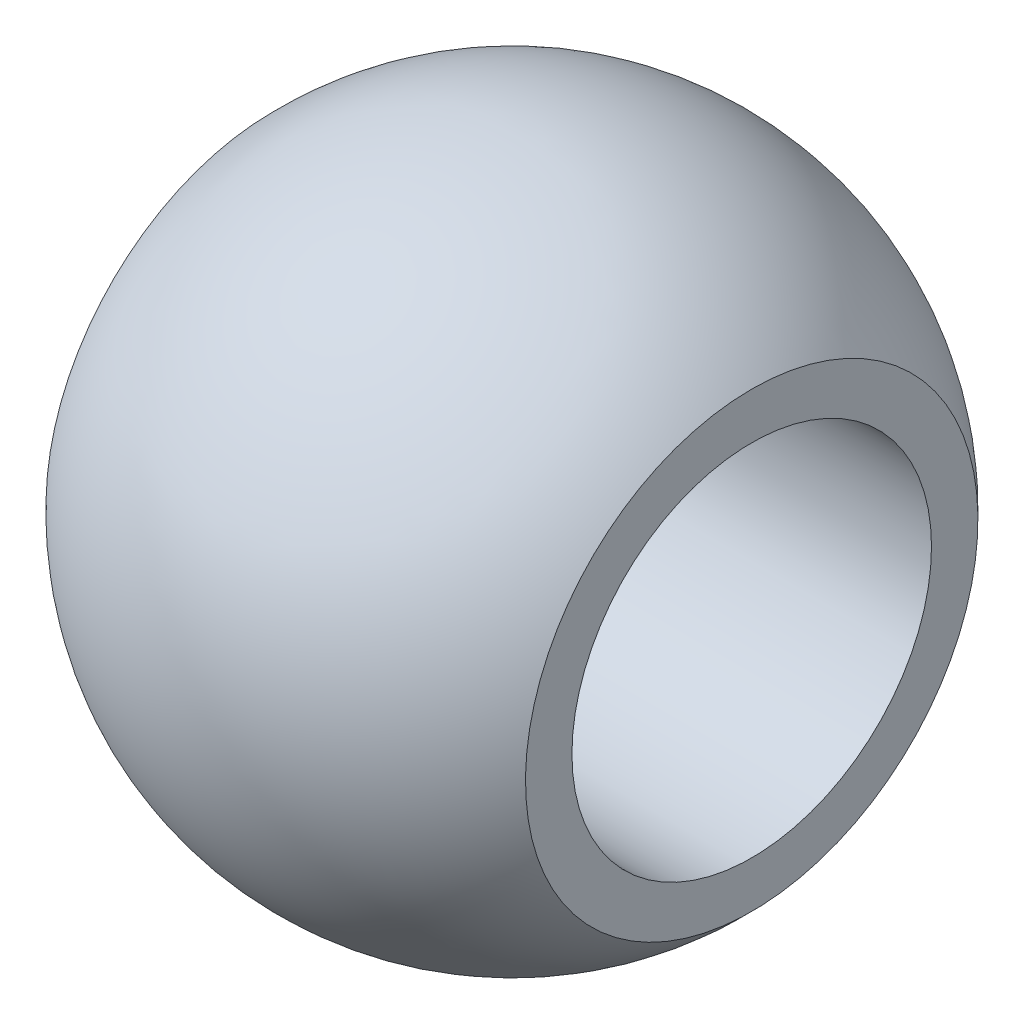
SolidWorks part; units mm, degrees
ref_plane "Plan1" through (0, 0, 0) normal (0, 0, 1) x (1, 0, 0)
ref_plane "Plan2" through (0, 0, 0) normal (0, 1, 0) x (1, 0, 0)
ref_plane "Plan3" through (0, 0, 0) normal (1, 0, 0) x (0, 0, -1)
sketch "Esquisse1" plane through (0, 0, 0) normal (0, 0, 1) x (1, 0, 0)
  line L0 (-8, 7.5498) -> (-8, 6)
  line L1 (8, 7.5498) -> (8, 6)
  line L2 (-8, 6) -> (8, 6)
  line L3 (0, 0) -> (-10, 0) construction
  arc A0 (8, 7.5498) -> (-8, 7.5498) centre (0, 0) ccw
  dimension "D1" = 22
  dimension "D2" = 8
  dimension "D3" = 8
  dimension "D4" = 6
revolve "Base-Révolution" add sketch "Esquisse1" angle 360 about L3
